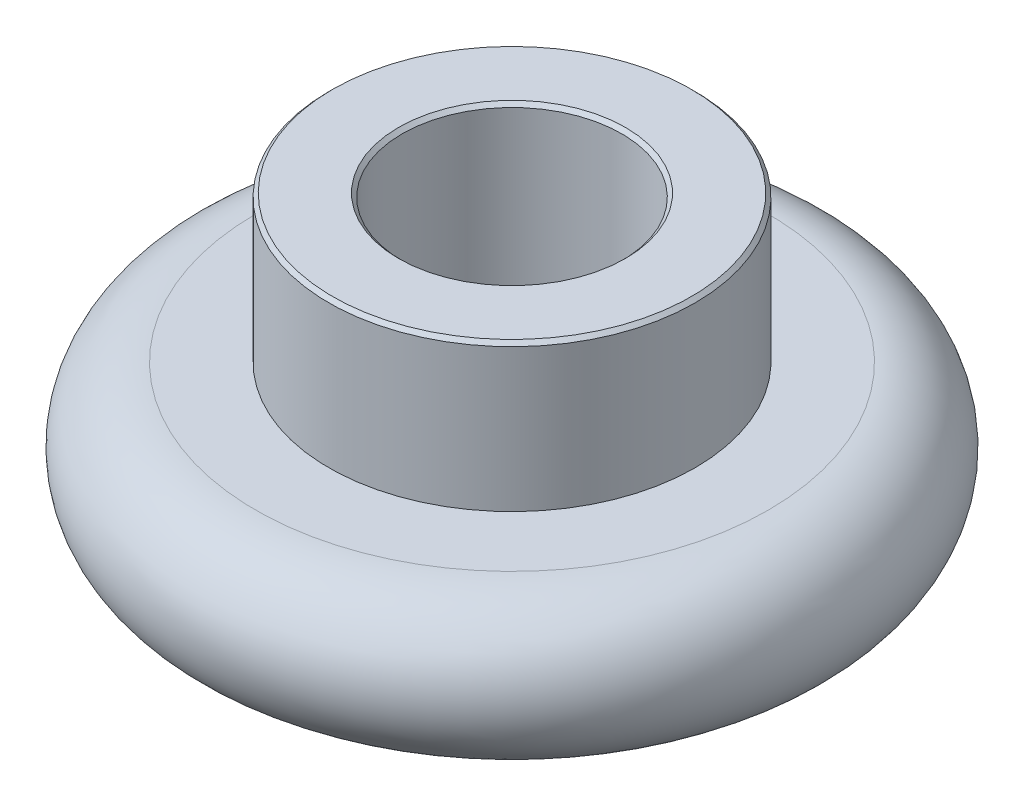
SolidWorks part; units mm, degrees
ref_plane "Спереди" through (0, 0, 0) normal (0, 0, 1) x (1, 0, 0)
ref_plane "Сверху" through (0, 0, 0) normal (0, 1, 0) x (1, 0, 0)
ref_plane "Справа" through (0, 0, 0) normal (1, 0, 0) x (0, 0, -1)
sketch "Эскиз1" plane through (0, 0, 0) normal (0, 0, 1) x (1, 0, 0)
  line L0 (0, 10) -> (0, 0)
  line L1 (0, 0) -> (-35, 0)
  line L2 (0, 10) -> (-15, 10)
  line L3 (-15, 10) -> (-15, 40)
  line L4 (-15, 40) -> (-25, 40)
  line L5 (-25, 40) -> (-25, 20)
  line L6 (-25, 20) -> (-35, 20)
  arc A0 (-35, 20) -> (-35, 0) centre (-35, 10) ccw
  dimension "D1" = 20
  dimension "D2" = 15
  dimension "D3" = 25
  dimension "D4" = 30
  dimension "D5" = 35
revolve "Повернуть1" add sketch "Эскиз1" angle 360 about L0
chamfer "Фаска1" distance 0.5 angle 45 3 edges at (-15, 10, 0) (-15, 40, 0) (-25, 40, 0)
